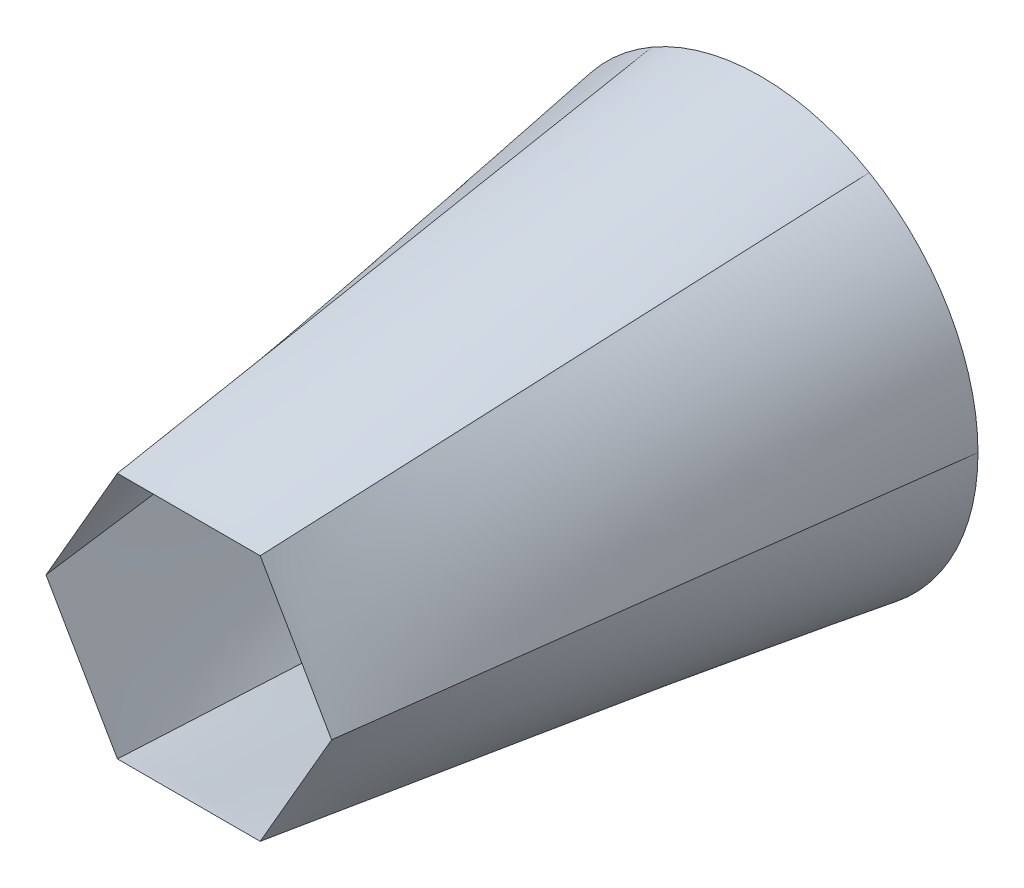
SolidWorks part; units mm, degrees
ref_plane "Front" through (0, 0, 0) normal (0, 0, 1) x (1, 0, 0)
ref_plane "Top" through (0, 0, 0) normal (0, 1, 0) x (1, 0, 0)
ref_plane "Right" through (0, 0, 0) normal (1, 0, 0) x (0, 0, -1)
sketch "Sketch1" plane through (0, 0, 0) normal (0, 0, 1) x (1, 0, 0)
  line L1 (49.9408, 0) -> (24.9704, 43.25)
  line L2 (24.9704, 43.25) -> (-24.9704, 43.25)
  line L3 (-24.9704, 43.25) -> (-49.9408, 0)
  line L4 (-49.9408, 0) -> (-24.9704, -43.25)
  line L5 (-24.9704, -43.25) -> (24.9704, -43.25)
  line L6 (24.9704, -43.25) -> (49.9408, 0)
  circle A0 centre (0, 0) radius 43.25 construction
  dimension "D1" = 86.5
ref_plane "Plane1" through (0, 0, -200) normal (0, 0, 1) x (1, 0, 0)
sketch "Sketch2" plane through (0, 0, -200) normal (0, 0, 1) x (1, 0, 0)
  circle A0 centre (0, 0) radius 76
  dimension "D1" = 152
surface "Surface-Loft1"
